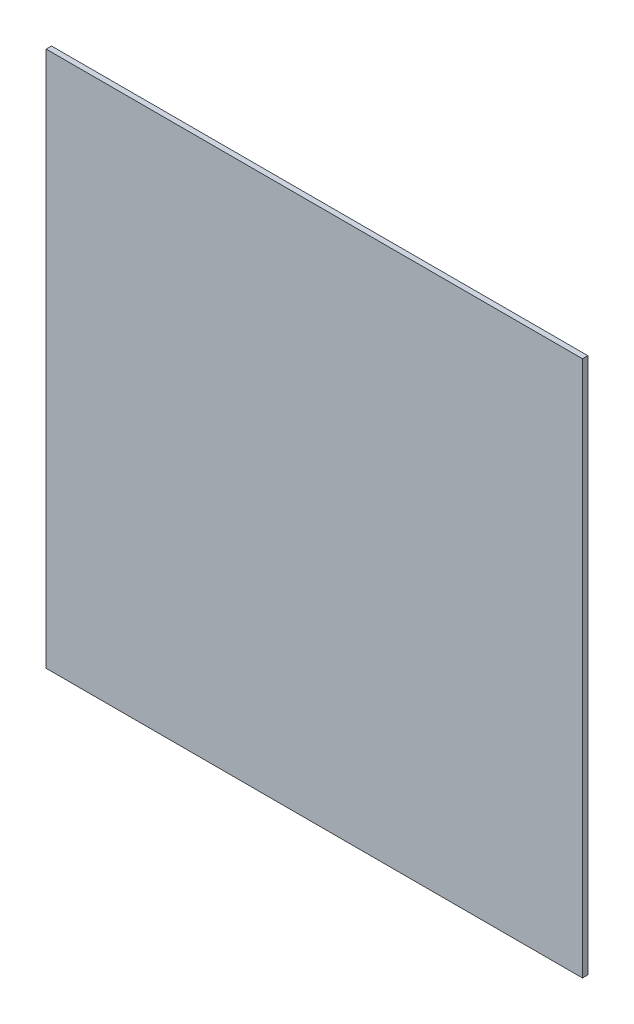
SolidWorks part; units mm, degrees
ref_plane "Front Plane" through (0, 0, 0) normal (0, 0, 1) x (1, 0, 0)
ref_plane "Top Plane" through (0, 0, 0) normal (0, 1, 0) x (1, 0, 0)
ref_plane "Right Plane" through (0, 0, 0) normal (1, 0, 0) x (0, 0, -1)
sketch "Sketch1" plane through (0, 0, 0) normal (0, 0, 1) x (1, 0, 0)
  line L1 (0, 0) -> (254, 0)
  line L2 (0, 0) -> (0, 254)
  line L3 (0, 254) -> (254, 254)
  line L4 (254, 0) -> (254, 254)
  dimension "D1" = 254
extrude "Boss-Extrude1" add sketch "Sketch1" along normal blind 2.54
sketch "Sketch2" plane through (0, 0, 2.54) normal (0, 0, 1) x (1, 0, 0)
  text T1 "NIST" font "Century Gothic" height in points 72
